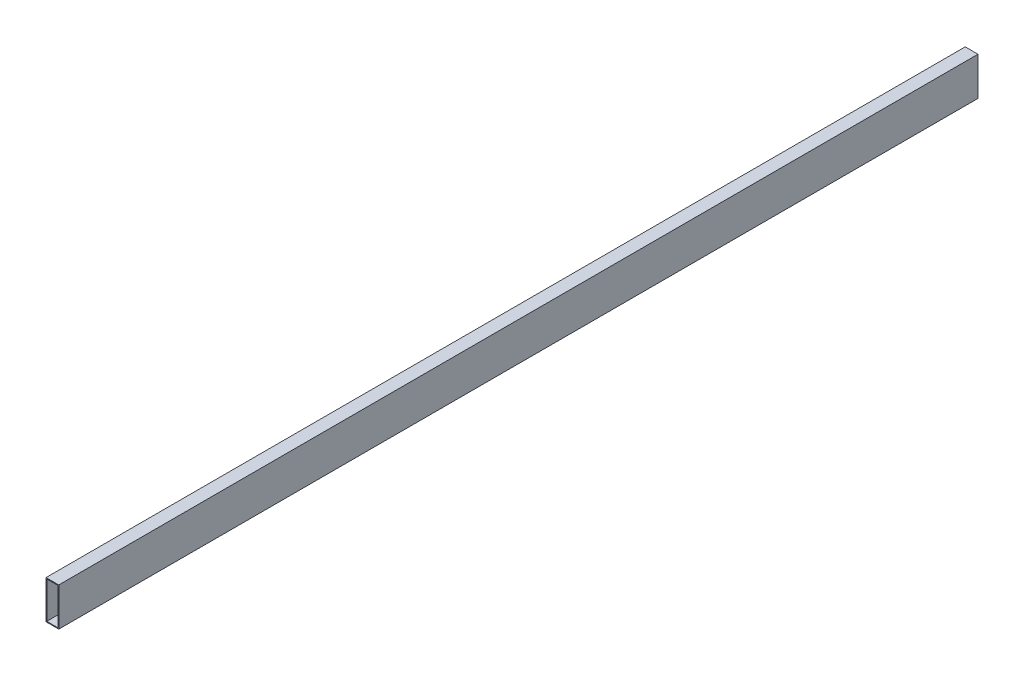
SolidWorks part; units mm, degrees
ref_plane "Front Plane" through (0, 0, 0) normal (0, 0, 1) x (1, 0, 0)
ref_plane "Top Plane" through (0, 0, 0) normal (0, 1, 0) x (1, 0, 0)
ref_plane "Right Plane" through (0, 0, 0) normal (1, 0, 0) x (0, 0, -1)
ref_plane "Plane1" through (0, 0, 3657.6) normal (0, 0, 1) x (1, 0, 0)
sketch "Sketch1" plane through (0, 0, 3657.6) normal (0, 0, 1) x (1, 0, 0)
  line L0 (0, 152.4) -> (0, 0)
  line L1 (0, 0) -> (50.8, 0)
  line L2 (50.8, 0) -> (50.8, 152.4)
  line L3 (50.8, 152.4) -> (0, 152.4)
  line L4 (3.175, 3.175) -> (3.175, 149.225)
  line L5 (3.175, 149.225) -> (47.625, 149.225)
  line L6 (47.625, 149.225) -> (47.625, 3.175)
  line L7 (47.625, 3.175) -> (3.175, 3.175)
extrude "Boss-Extrude1" add sketch "Sketch1" against normal blind 3657.6
